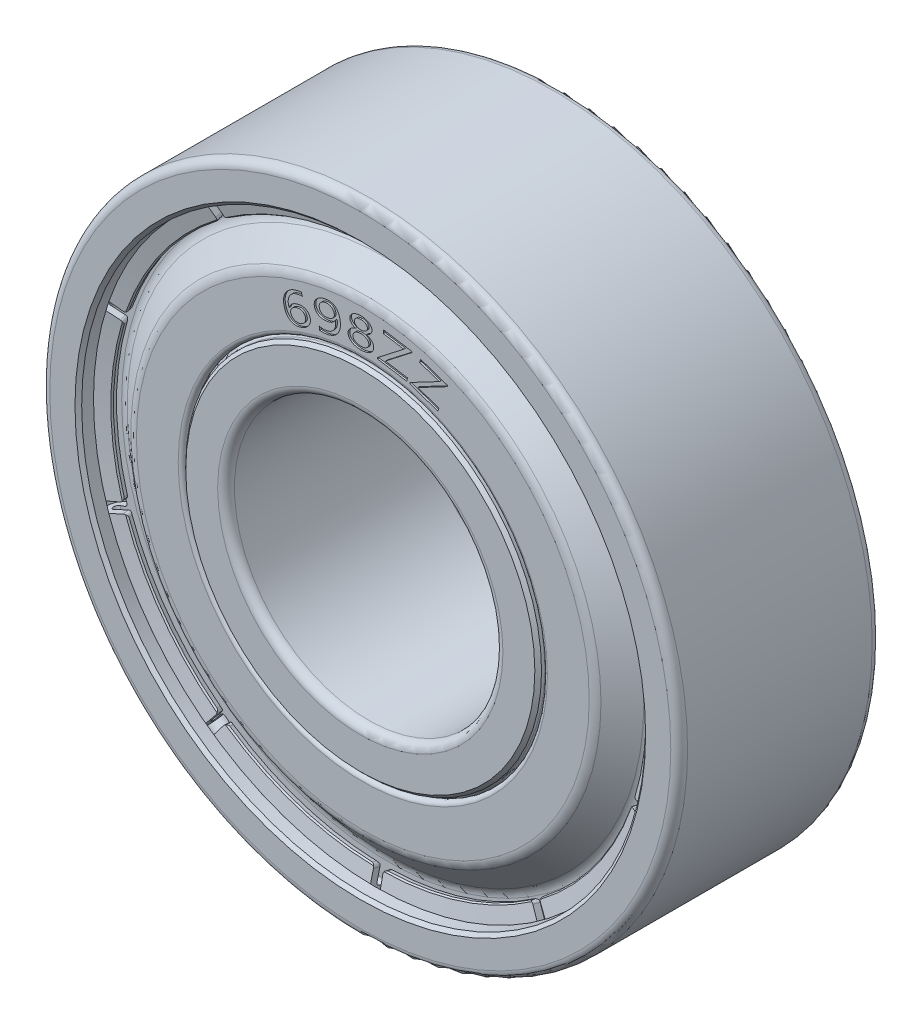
SolidWorks part; units mm, degrees
ref_plane "Front Plane" through (0, 0, 0) normal (0, 0, 1) x (1, 0, 0)
ref_plane "Top Plane" through (0, 0, 0) normal (0, 1, 0) x (1, 0, 0)
ref_plane "Right Plane" through (0, 0, 0) normal (1, 0, 0) x (0, 0, -1)
sketch "Sketch1" plane through (0, 0, 0) normal (1, 0, 0) x (0, 0, -1)
  line L0 (0, -1000) -> (0, 49000) construction
  line L1 (-1000, 0) -> (49000, 0) construction
  line L2 (0, 9.5) -> (0, 4) construction
  line L3 (-2.75, 4) -> (2.75, 4)
  line L4 (-3, 4.25) -> (-3, 9.25)
  line L5 (-2.75, 9.5) -> (2.75, 9.5)
  line L6 (3, 4.25) -> (3, 9.25)
  line L7 (3, 8) -> (1.0383, 8)
  line L8 (-3, 6.75) -> (3, 6.75) construction
  line L9 (-1.0383, 8) -> (-3, 8)
  line L10 (3, 5.5) -> (1.0383, 5.5)
  line L11 (-1.0383, 5.5) -> (-3, 5.5)
  arc A0 (2.75, 9.5) -> (3, 9.25) centre (2.75, 9.25) cw
  arc A1 (2.75, 4) -> (3, 4.25) centre (2.75, 4.25) ccw
  arc A2 (-2.75, 4) -> (-3, 4.25) centre (-2.75, 4.25) cw
  arc A3 (-2.75, 9.5) -> (-3, 9.25) centre (-2.75, 9.25) ccw
  circle A4 centre (0, 6.75) radius 1.625
  dimension "D1" = 0.25
  dimension "D3" = 3.25
  dimension "D2" = 6
  dimension "D4" = 9.5
  dimension "D5" = 4
  dimension "D6" = 1.5
revolve "Revolve1" add sketch "Sketch1" angle 360 about L1
sketch "Sketch2" plane through (0, 0, 0) normal (1, 0, 0) x (0, 0, -1)
  line L0 (0, -1000) -> (0, 49000) construction
  line L1 (0, 5.125) -> (0, 8.375)
  arc A0 (0, 8.375) -> (0, 5.125) centre (0, 6.75) ccw
  arc A1 (-1.0383, 5.5) -> (1.0383, 5.5) centre (0, 6.75) ccw construction
  arc A2 (1.0383, 8) -> (-1.0383, 8) centre (0, 6.75) ccw construction
revolve "Revolve2" add sketch "Sketch2" angle 360 about L0
fillet "Fillet1" radius 0.25 2 edges at (8, 0, -1.0383) (8, 0, 1.0383)
fillet "Fillet2" radius 0.25 2 edges at (5.5, 0, -1.0383) (5.5, 0, 1.0383)
pattern_circular "CirPattern3" count 8 over 360 about axis through (0, 0, 0) along (0, 0, 1)
sketch "Sketch5" plane through (0, 0, 0) normal (1, 0, 0) x (0, 0, -1)
  line L0 (0, -1000) -> (0, 49000) construction
  line L1 (0, 8.375) -> (0, 5.125)
  line L2 (0, 8.375) -> (0, 8.425)
  line L3 (0, 5.125) -> (0, 5.075)
  line L4 (0, 8.425) -> (0, 8.675)
  line L5 (0, 4.825) -> (0, 5.075)
  circle A0 centre (0, 6.75) radius 1.625 construction
  arc A1 (0, 8.675) -> (0, 4.825) centre (0, 6.75) ccw
  arc A2 (0, 8.375) -> (0, 5.125) centre (0, 6.75) ccw
  arc A3 (0, 8.425) -> (0, 5.075) centre (0, 6.75) ccw
  dimension "D1" = 0.25
  dimension "D2" = 0.05
revolve "Revolve3" add sketch "Sketch5" angle 90 about L0
sketch "Sketch7" plane through (0, 0, 0) normal (0, 0, 1) x (1, 0, 0)
  line L0 (4.1257, 6.2635) -> (4.0837, 6.2907)
  line L1 (3.179, 5.0889) -> (3.1363, 5.115)
  line L2 (5.5691, 5.5691) -> (3.1808, 3.1808) construction
  arc A1 (1.57, 7.3338) -> (4.0837, 6.2907) centre (0, 0) cw
  circle A2 centre (0, 6.75) radius 1.675 construction
  circle A3 centre (4.773, 4.773) radius 1.625 construction
  arc A4 (3.1363, 5.115) -> (1.4022, 5.8338) centre (0, 0) ccw
  arc A5 (4.0837, 6.2907) -> (3.1363, 5.115) centre (4.769, 4.769) ccw
  circle A6 centre (0, 0) radius 8 construction
  circle A8 centre (0, 0) radius 5.5 construction
  arc A9 (1.4022, 5.8338) -> (1.57, 7.3338) centre (0, 6.75) ccw
  arc A10 (2.9105, 5.2468) -> (3.8351, 6.4453) centre (4.769, 4.769) cw construction
  dimension "D1" = 0.5
  dimension "D2" = 0.5
  dimension "D4" = 0.25
  dimension "D3" = 0.05
extrude "Boss-Extrude1" add sketch "Sketch7" along normal blind 0.25 contours A9 A4 A5 A1
sketch "Sketch8" plane through (0, 0, 0) normal (0, 0, 1) x (1, 0, 0)
  line L0 (4.1257, 6.2635) -> (4.0837, 6.2907) construction
  circle A0 centre (0, 0) radius 8.675
  arc A1 (1.8542, 7.2672) -> (1.6552, 5.7672) centre (0, 6.75) ccw construction
  circle A2 centre (0, 0) radius 7.5
extrude "Cut-Extrude1" cut sketch "Sketch8" along normal through all
sketch "Sketch9" plane through (0, 0, 0) normal (0, 0, 1) x (1, 0, 0)
  line L0 (3.179, 5.0889) -> (3.1363, 5.115) construction
  circle A0 centre (0, 0) radius 6
extrude "Cut-Extrude2" cut sketch "Sketch9" along normal through all
sketch "Sketch10" plane through (0, 0, 0) normal (0, 0, 1) x (1, 0, 0)
  line L0 (2.8746, 6.9273) -> (2.2976, 5.5427) construction
  arc A0 (4.0837, 6.2907) -> (1.57, 7.3338) centre (0, 0) ccw construction
  arc A1 (3.1363, 5.115) -> (1.4022, 5.8338) centre (0, 0) ccw construction
  circle A2 centre (2.5861, 6.235) radius 0.25
  dimension "D1" = 0.5
extrude "Cut-Extrude3" cut sketch "Sketch10" along normal up to next
ref_plane "Plane2" through (0, 0, 0) normal (-0.9237, 0.3831, 0) x (0, 0, 1)
sketch "Sketch12" plane through (0, 0, 0) normal (-0.9237, 0.3831, 0) x (0, 0, 1)
  line L0 (-1000, 6.75) -> (49000, 6.75) construction
  line L2 (0, 6.5) -> (0.25, 6.5) construction
  line L3 (0.25, 7) -> (0, 7) construction
  line L4 (0.125, 7) -> (0.125, 6.5) construction
  line L5 (0.25, 7) -> (-0.25, 7)
  line L7 (-0.525, 6.75) -> (0.525, 6.75)
  line L10 (0, -993.3492) -> (0, 49006.6508) construction
  line L11 (0, 7.3757) -> (0, 5.9259) construction
  arc A0 (-0.25, 7) -> (-0.3771, 7.0605) centre (-0.328, 7) ccw
  arc A1 (-0.3771, 7.0605) -> (-0.525, 6.75) centre (-0.125, 6.75) ccw
  arc A2 (0.25, 7) -> (0.3771, 7.0605) centre (0.328, 7) cw
  arc A3 (0.525, 6.75) -> (0.3771, 7.0605) centre (0.125, 6.75) ccw
  point P24 (0, 6.6508)
  dimension "D1" = 0.4
revolve "Revolve4" add sketch "Sketch12" angle 360 about L0
pattern_circular "CirPattern4" count 8 over 360 about axis through (0, 0, 0) along (0, 0, 1)
combine bodies "Combine2" bodies to combine 128 129 130 115 124 125 126 127
fillet "Fillet3" radius 0.25 88 edges at (-3.4695, -5.8161, 0) (0.2097, -5.9963, 1.4811) (1.6214, -6.3492, 0.1261) (-1.6646, -6.5639, 0) (-1.8924, -6.5015, 0.25) (-0.5075, -7.4828, 1.7062) (-3.6186, -5.978, 0.1444) (-3.1363, -5.115, 0.0502) (-3.2591, -5.9354, 0.25) (-5.9354, -3.2591, 0.25) (-6.5659, -1.6593, 0) (-5.8184, -3.4643, 0) (-5.5956, -4.994, 1.4423) (-5.65, -4.9323, 1.7062) (-4.0917, -4.3884, 1.4811) (-4.4406, -4.035, 1.7466) (-6.5015, -1.8924, 0.25) (-7.3358, -1.5606, 0.0822) (-5.8346, -1.3991, 0.0502) (-6.3492, -1.6214, 0.1261) (-0.2868, -5.9931, 1.7466) (4.035, -4.4406, 1.7466) (5.9931, -0.2868, 1.7466) (4.4406, 4.035, 1.7466) (0.2868, 5.9931, 1.7466) (-4.035, 4.4406, 1.7466) (-5.9931, 0.2868, 1.7466) (-4.0837, -6.2907, 0.0822) (-0.4254, -7.4879, 1.4423) (1.5606, -7.3358, 0.0822) (4.994, -5.5956, 1.4423) (6.2907, -4.0837, 0.0822) (7.4879, -0.4254, 1.4423) (7.3358, 1.5606, 0.0822) (5.5956, 4.994, 1.4423) (4.0837, 6.2907, 0.0822) (0.4254, 7.4879, 1.4423) (-1.5606, 7.3358, 0.0822) (-4.994, 5.5956, 1.4423) (-6.2907, 4.0837, 0.0822) (-7.4879, 0.4254, 1.4423) (-5.9354, 3.2591, 0.25) (-5.8161, 3.4695, 0) (-5.9963, -0.2097, 1.4811) (-6.5639, 1.6646, 0) (-6.5015, 1.8924, 0.25) (-7.4828, 0.5075, 1.7062) (-5.115, 3.1363, 0.0502) (-1.8924, 6.5015, 0.25) (-1.6593, 6.5659, 0) (-4.3884, 4.0917, 1.4811) (-5.6361, 3.3431, 0.1261) (-3.4643, 5.8184, 0) (-3.2591, 5.9354, 0.25) (-4.9323, 5.65, 1.7062) (-1.3991, 5.8346, 0.0502) (3.2591, 5.9354, 0.25) (3.4695, 5.8161, 0) (-0.2097, 5.9963, 1.4811) (-1.6214, 6.3492, 0.1261) (1.6646, 6.5639, 0) (1.8924, 6.5015, 0.25) (0.5075, 7.4828, 1.7062) (3.1363, 5.115, 0.0502) (6.5015, 1.8924, 0.25) (6.5659, 1.6593, 0) (4.0917, 4.3884, 1.4811) (3.3431, 5.6361, 0.1261) (5.8184, 3.4643, 0) (5.9354, 3.2591, 0.25) (5.65, 4.9323, 1.7062) (5.8346, 1.3991, 0.0502) (5.9354, -3.2591, 0.25) (5.8161, -3.4695, 0) (5.9963, 0.2097, 1.4811) (6.3492, 1.6214, 0.1261) (6.5639, -1.6646, 0) (6.5015, -1.8924, 0.25) (7.4828, -0.5075, 1.7062) (5.115, -3.1363, 0.0502) (1.8924, -6.5015, 0.25) (1.6593, -6.5659, 0) (4.3884, -4.0917, 1.4811) (5.6361, -3.3431, 0.1261) (3.4643, -5.8184, 0) (3.2591, -5.9354, 0.25) (4.9323, -5.65, 1.7062) (1.3991, -5.8346, 0.0502)
chamfer "Chamfer1" distance 0.05 angle 45 192 edges at (-0.2426, 5.9951, 1.7541) (-0.1205, 7.499, 1.7692) (-1.8582, 6.5114, 0.4425) (1.8582, 6.5114, 0.4425) (2.2961, 5.5433, 0.25) (2.8701, 6.9291, 0.25) (3.0726, 6.0337, 0.25) (2.0938, 6.4391, 0.25) (0.2403, 5.9952, 1.4759) (0.4254, 7.4879, 1.4423) (-1.6507, 6.5674, 0.2175) (1.6507, 6.5674, 0.2175) (-5.9951, -0.2426, 1.7541) (-5.5433, -2.2961, 0.25) (-4.0676, -4.4107, 1.7541) (-2.2961, -5.5433, 0.25) (0.2426, -5.9951, 1.7541) (2.2961, -5.5433, 0.25) (4.4107, -4.0676, 1.7541) (5.5433, -2.2961, 0.25) (5.9951, 0.2426, 1.7541) (5.5433, 2.2961, 0.25) (4.0676, 4.4107, 1.7541) (-2.2961, 5.5433, 0.25) (-4.4107, 4.0676, 1.7541) (-5.5433, 2.2961, 0.25) (-0.2403, -5.9952, 1.4759) (-2.2961, -5.5433, 0) (-4.4091, -4.0693, 1.4759) (-5.5433, -2.2961, 0) (-5.9952, 0.2403, 1.4759) (-5.5433, 2.2961, 0) (-4.0693, 4.4091, 1.4759) (-2.2961, 5.5433, 0) (2.2961, 5.5433, 0) (4.4091, 4.0693, 1.4759) (5.5433, 2.2961, 0) (5.9952, -0.2403, 1.4759) (5.5433, -2.2961, 0) (4.0693, -4.4091, 1.4759) (2.2961, -5.5433, 0) (-1.4764, 5.8155, 0.0591) (-3.0831, 5.1473, 0.0743) (-5.1562, 3.0682, 0.0591) (-5.8198, 1.4596, 0.0743) (-5.8155, -1.4764, 0.0591) (-3.0682, -5.1562, 0.0591) (-1.4596, -5.8198, 0.0743) (-5.1473, -3.0831, 0.0743) (1.4764, -5.8155, 0.0591) (3.0831, -5.1473, 0.0743) (5.1562, -3.0682, 0.0591) (5.8198, -1.4596, 0.0743) (5.8155, 1.4764, 0.0591) (5.1473, 3.0831, 0.0743) (3.0682, 5.1562, 0.0591) (1.4596, 5.8198, 0.0743) (2.8701, 6.9291, 0) (3.2591, 5.9354, 0) (1.8924, 6.5015, 0) (-2.8701, -6.9291, 0) (-0.4254, -7.4879, 1.4423) (2.8701, -6.9291, 0) (4.994, -5.5956, 1.4423) (6.9291, -2.8701, 0) (7.4879, -0.4254, 1.4423) (6.9291, 2.8701, 0) (5.5956, 4.994, 1.4423) (-2.8701, 6.9291, 0) (-4.994, 5.5956, 1.4423) (-6.9291, 2.8701, 0) (-7.4879, 0.4254, 1.4423) (-6.9291, -2.8701, 0) (-5.5956, -4.994, 1.4423) (-2.8701, -6.9291, 0.25) (-5.2174, -5.3878, 1.7692) (-6.9291, -2.8701, 0.25) (-7.499, -0.1205, 1.7692) (-6.9291, 2.8701, 0.25) (-5.3878, 5.2174, 1.7692) (-2.8701, 6.9291, 0.25) (5.2174, 5.3878, 1.7692) (6.9291, 2.8701, 0.25) (7.499, 0.1205, 1.7692) (6.9291, -2.8701, 0.25) (5.3878, -5.2174, 1.7692) (2.8701, -6.9291, 0.25) (0.1205, -7.499, 1.7692) (-1.6251, 7.3218, 0.0829) (-4.0296, 6.3255, 0.0845) (-6.3264, 4.0282, 0.0829) (-7.3222, 1.6234, 0.0845) (-7.3218, -1.6251, 0.0829) (-4.0282, -6.3264, 0.0829) (-1.6234, -7.3222, 0.0845) (-6.3255, -4.0296, 0.0845) (1.6251, -7.3218, 0.0829) (4.0296, -6.3255, 0.0845) (6.3264, -4.0282, 0.0829) (7.3222, -1.6234, 0.0845) (7.3218, 1.6251, 0.0829) (6.3255, 4.0296, 0.0845) (4.0282, 6.3264, 0.0829) (1.6234, 7.3222, 0.0845) (5.9182, 3.2903, 0.4425) (3.2903, 5.9182, 0.4425) (5.8111, 3.4766, 0.2175) (3.4766, 5.8111, 0.2175) (6.4391, 2.0938, 0.25) (6.0337, 3.0726, 0.25) (6.5015, 1.8924, 0) (5.9354, 3.2591, 0) (6.5114, -1.8582, 0.4425) (6.5114, 1.8582, 0.4425) (6.5674, -1.6507, 0.2175) (6.5674, 1.6507, 0.2175) (6.0337, -3.0726, 0.25) (6.4391, -2.0938, 0.25) (5.9354, -3.2591, 0) (6.5015, -1.8924, 0) (3.2903, -5.9182, 0.4425) (5.9182, -3.2903, 0.4425) (3.4766, -5.8111, 0.2175) (5.8111, -3.4766, 0.2175) (2.0938, -6.4391, 0.25) (3.0726, -6.0337, 0.25) (1.8924, -6.5015, 0) (3.2591, -5.9354, 0) (-1.8582, -6.5114, 0.4425) (1.8582, -6.5114, 0.4425) (-1.6507, -6.5674, 0.2175) (1.6507, -6.5674, 0.2175) (-3.2903, -5.9182, 0.4425) (-5.9182, -3.2903, 0.4425) (-6.4391, -2.0938, 0.25) (-6.0337, -3.0726, 0.25) (-3.4766, -5.8111, 0.2175) (-5.8111, -3.4766, 0.2175) (-6.5015, -1.8924, 0) (-5.9354, -3.2591, 0) (-3.0726, -6.0337, 0.25) (-2.0938, -6.4391, 0.25) (-3.2591, -5.9354, 0) (-1.8924, -6.5015, 0) (-6.5674, 1.6507, 0.2175) (-6.5674, -1.6507, 0.2175) (-6.5114, 1.8582, 0.4425) (-6.5114, -1.8582, 0.4425) (-6.0337, 3.0726, 0.25) (-6.4391, 2.0938, 0.25) (-5.9354, 3.2591, 0) (-6.5015, 1.8924, 0) (-3.4766, 5.8111, 0.2175) (-5.8111, 3.4766, 0.2175) (-3.2903, 5.9182, 0.4425) (-5.9182, 3.2903, 0.4425) (-1.8924, 6.5015, 0) (-3.2591, 5.9354, 0) (-2.0938, 6.4391, 0.25) (-3.0726, 6.0337, 0.25) (1.8852, 7.2592, 0.3113) (1.6874, 5.7578, 0.3073) (3.81, 6.4601, 0.3206) (2.8756, 5.266, 0.3049) (6.4661, 3.7999, 0.3113) (5.2646, 2.8782, 0.3073) (7.2621, 1.8739, 0.3206) (5.757, 1.6903, 0.3049) (7.2592, -1.8852, 0.3113) (5.7578, -1.6874, 0.3073) (6.4601, -3.81, 0.3206) (5.266, -2.8756, 0.3049) (3.7999, -6.4661, 0.3113) (2.8782, -5.2646, 0.3073) (1.8739, -7.2621, 0.3206) (1.6903, -5.757, 0.3049) (-6.4661, -3.7999, 0.3113) (-5.2646, -2.8782, 0.3073) (-1.8852, -7.2592, 0.3113) (-1.6874, -5.7578, 0.3073) (-2.8756, -5.266, 0.3049) (-3.81, -6.4601, 0.3206) (-7.2621, -1.8739, 0.3206) (-5.757, -1.6903, 0.3049) (-7.2592, 1.8852, 0.3113) (-5.7578, 1.6874, 0.3073) (-6.4601, 3.81, 0.3206) (-5.266, 2.8756, 0.3049) (-3.7999, 6.4661, 0.3113) (-2.8782, 5.2646, 0.3073) (-1.8739, 7.2621, 0.3206) (-1.6903, 5.757, 0.3049)
sketch "Sketch13" plane through (0, 0, 0) normal (1, 0, 0) x (0, 0, -1)
  line L1 (-2.5563, 8.4649) -> (-2.5563, 8.4) construction
  line L4 (-2.5563, 8.4) -> (-3, 8.4) construction
  line L6 (0, -1000) -> (0, 49000) construction
  line L7 (-1000, 0) -> (49000, 0) construction
  line L8 (-2.4466, 7.9371) -> (-2.5492, 8.4) construction
  line L9 (-2.5563, 8.4) -> (-2.5492, 8.4) construction
  line L10 (-2.4466, 7.9371) -> (-2.2514, 7.9804) construction
  line L11 (-2.2514, 7.9804) -> (-2.354, 8.4433) construction
  line L12 (-2.1563, 8.4649) -> (-2.1563, 7.8061) construction
  line L13 (-2.1563, 7.8061) -> (-2.925, 6.8901) construction
  line L14 (-1.9563, 8.4649) -> (-1.9563, 7.6556) construction
  line L15 (-1.9563, 7.6556) -> (-2.675, 6.7991) construction
  line L16 (-2.925, 6.8901) -> (-2.925, 5.5) construction
  line L17 (-1.125, 5.5) -> (-3, 5.5) construction
  line L18 (-2.675, 6.7991) -> (-2.675, 5.5) construction
  line L19 (-3, 9.25) -> (-3, -9.25) construction
  line L20 (-2.925, 5.5) -> (-2.675, 5.5) construction
  line L21 (-2.8, 5.3) -> (-3, 5.3) construction
  circle A2 centre (-2.2563, 8.4649) radius 0.3 construction
  circle A3 centre (-2.2563, 8.4649) radius 0.1 construction
  arc A4 (-2.925, 5.5) -> (-2.675, 5.5) centre (-2.8, 5.5) ccw construction
  circle A5 centre (-2.8, 5.5) radius 0.2 construction
  dimension "D1" = 0.6
  dimension "D6" = 0.25
  dimension "D2" = 12.5
  dimension "D3" = 0.2
  dimension "D4" = 0.2
  dimension "D5" = 40
  dimension "D7" = 0.25
  dimension "D8" = 0.075
  dimension "D9" = 8.4
sketch "Sketch15" plane through (0, 0, 0) normal (1, 0, 0) x (0, 0, -1)
  line L0 (-3, 5.3) -> (-2.8, 5.3)
  line L1 (-3, 5.3) -> (-3, 5.5)
  line L2 (-2.5563, 8.4649) -> (-2.5492, 8.4)
  line L3 (-2.5492, 8.4) -> (-3, 8.4)
  line L4 (-3, 8.4) -> (-3, 8)
  line L5 (-3, 8) -> (-1.9563, 8)
  line L6 (-1.9563, 8.4649) -> (-1.9563, 7.6556) construction
  line L7 (-1.125, 8) -> (-3, 8) construction
  line L8 (-1.9563, 8) -> (-1.9563, 8.4649)
  line L9 (0, -988.4138) -> (0, 48721.0868) construction
  line L11 (1.9563, 8) -> (1.9563, 8.4649)
  line L12 (3, 8) -> (1.9563, 8)
  line L13 (3, 8.4) -> (3, 8)
  line L14 (2.5492, 8.4) -> (3, 8.4)
  line L15 (2.5563, 8.4649) -> (2.5492, 8.4)
  line L16 (3, 5.3) -> (3, 5.5)
  line L17 (3, 5.3) -> (2.8, 5.3)
  line L18 (-1000, 0) -> (49000, 0) construction
  arc A0 (-3, 5.5) -> (-2.8, 5.3) centre (-2.8, 5.5) cw
  arc A1 (-1.9563, 8.4649) -> (-2.5563, 8.4649) centre (-2.2563, 8.4649) ccw
  arc A2 (1.9563, 8.4649) -> (2.5563, 8.4649) centre (2.2563, 8.4649) cw
  arc A3 (3, 5.5) -> (2.8, 5.3) centre (2.8, 5.5) ccw
revolve "Cut-Revolve1" cut sketch "Sketch15" angle 360 about L18
sketch "Sketch17" plane through (0, 0, 0) normal (1, 0, 0) x (0, 0, -1)
  line L0 (-2.1563, 8.4649) -> (-2.1563, 7.9517)
  line L1 (-2.1563, 8.4649) -> (-2.1563, 7.8061) construction
  line L2 (-2.354, 8.4433) -> (-2.26, 8.0195)
  line L3 (-2.2514, 7.9804) -> (-2.354, 8.4433) construction
  line L4 (-2.5492, 8.4) -> (-2.4553, 7.9762)
  line L5 (-2.4466, 7.9371) -> (-2.5492, 8.4) construction
  line L9 (-1.9563, 8.4649) -> (-1.9563, 7.8012)
  line L10 (-1.9563, 8.4649) -> (-1.9563, 7.6556) construction
  line L11 (-2.0499, 7.544) -> (-2.5814, 6.9106)
  line L12 (-1.9563, 7.6556) -> (-2.675, 6.7991) construction
  line L13 (-2.1563, 7.8061) -> (-2.925, 6.8901) construction
  line L14 (-2.2499, 7.6946) -> (-2.8314, 7.0016)
  line L15 (-2.925, 6.7445) -> (-2.925, 5.5)
  line L16 (-2.925, 6.8901) -> (-2.925, 5.5) construction
  line L17 (-2.675, 6.6535) -> (-2.675, 5.5)
  line L18 (-2.675, 6.7991) -> (-2.675, 5.5) construction
  line L19 (-2.4553, 7.9762) -> (-2.4076, 7.9458)
  line L20 (-2.4076, 7.9458) -> (-2.2904, 7.9718)
  line L21 (-2.2904, 7.9718) -> (-2.26, 8.0195)
  line L22 (-2.4553, 7.9762) -> (-2.4466, 7.9371) construction
  line L23 (-2.4076, 7.9458) -> (-2.4466, 7.9371) construction
  line L24 (-2.4553, 7.9762) -> (-2.26, 8.0195) construction
  line L25 (-2.4466, 7.9371) -> (-2.2514, 7.9804) construction
  line L26 (-1000, 0) -> (49000, 0) construction
  arc A0 (-2.1563, 8.4649) -> (-2.354, 8.4433) centre (-2.2563, 8.4649) ccw
  arc A1 (-2.5492, 8.4) -> (-1.9563, 8.4649) centre (-2.2563, 8.4649) cw
  arc A2 (-2.925, 5.5) -> (-2.675, 5.5) centre (-2.8, 5.5) ccw
  arc A3 (-2.925, 6.7445) -> (-2.8314, 7.0016) centre (-2.525, 6.7445) cw
  arc A4 (-2.675, 6.6535) -> (-2.5814, 6.9106) centre (-2.275, 6.6535) cw
  arc A5 (-1.9563, 7.8012) -> (-2.0499, 7.544) centre (-2.3563, 7.8012) cw
  arc A6 (-2.1563, 7.9517) -> (-2.2499, 7.6946) centre (-2.5563, 7.9517) cw
  dimension "D4" = 0.4
  dimension "D1" = 0.04
  dimension "D2" = 0.04
  dimension "D3" = 0.04
revolve "Revolve5" add sketch "Sketch17" angle 360 about L7
mirror "Mirror1" about plane through (0, 0, 0) normal (0, 0, -1)
sketch "Sketch18" plane through (0, 0, 0) normal (1, 0, 0) x (0, 0, -1)
  line L0 (-2.1563, 8.4649) -> (-2.1563, 8.2149)
  line L1 (-2.1563, 8.4649) -> (-2.1563, 7.8061) construction
  line L2 (-1.9563, 8.4649) -> (-1.9563, 8.2149)
  line L3 (-1.9563, 8.4649) -> (-1.9563, 7.6556) construction
  line L4 (-2.354, 8.4433) -> (-2.2514, 7.9804)
  line L6 (-2.2514, 7.9804) -> (-2.354, 8.4433) construction
  line L7 (-2.4466, 7.9371) -> (-2.5492, 8.4) construction
  line L8 (-2.4466, 7.9371) -> (-2.5492, 8.4)
  line L9 (-2.4466, 7.9371) -> (-2.2514, 7.9804)
  line L10 (-1.9563, 8.2149) -> (-2.1563, 8.2149)
  arc A0 (-2.5492, 8.4) -> (-1.9563, 8.4649) centre (-2.2563, 8.4649) cw
  arc A1 (-2.354, 8.4433) -> (-2.1563, 8.4649) centre (-2.2563, 8.4649) cw
  dimension "D1" = 0.25
revolve "Cut-Revolve3" cut sketch "Sketch18" angle 1 about L7
fillet "Fillet4" radius 0.1 4 edges at (0.1434, 8.2137, 2.0563) (-0.1434, 8.2137, 2.0563) (-0.1389, 7.9576, 2.349) (0.1389, 7.9576, 2.349)
pattern_circular "CirPattern5" count 10 over 360 about axis through (0, 0, 1000) along (0, 0, 1) of "Cut-Revolve3", "Fillet4"
mirror "Mirror2" about plane through (0, 0, 0) normal (0, 0, 1)
sketch "Sketch19" plane through (0, 0, 2.925) normal (0, 0, 1) x (1, 0, 0)
  line L2 (-5, 2.6311) -> (5, 2.6311) construction
  arc A0 (-5, 2.6311) -> (5, 2.6311) centre (0, 0) cw construction
  text T0 "698ZZ" font "Microsoft YaHei" height in points 3
  dimension "D1" = 5.65
  dimension "D2" = 10
extrude "Cut-Extrude4" cut sketch "Sketch19" against normal blind 0.05
chamfer "Chamfer2" distance 0.1 angle 45 2 edges at (5.3, 0, -3) (5.3, 0, 3)
chamfer "Chamfer3" distance 0.1 angle 45 2 edges at (8.4, 0, 3) (8.4, 0, -3)
